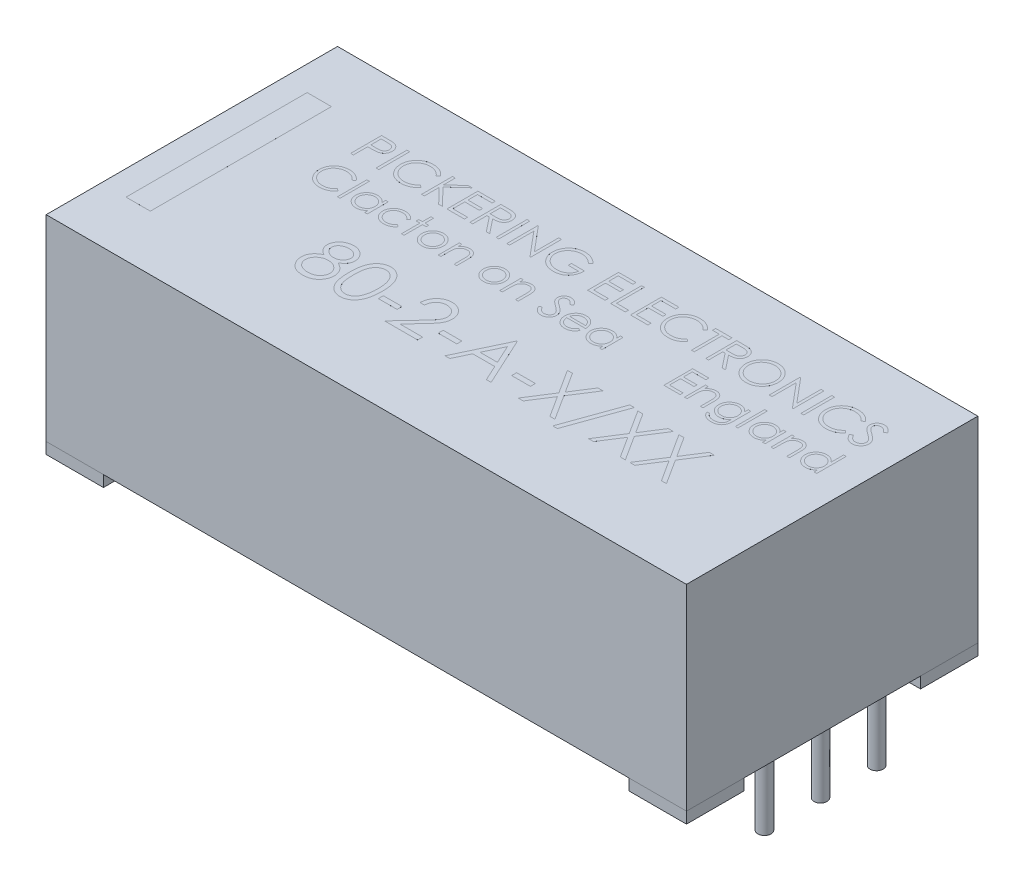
SolidWorks part; units mm, degrees
ref_plane "Front Plane" through (0, 0, 0) normal (0, 0, 1) x (1, 0, 0)
ref_plane "Top Plane" through (0, 0, 0) normal (0, 1, 0) x (1, 0, 0)
ref_plane "Right Plane" through (0, 0, 0) normal (1, 0, 0) x (0, 0, -1)
sketch "Sketch2" plane through (0, 0, 0) normal (0, 1, 0) x (1, 0, 0)
  line L1 (14.5, -6.6) -> (-14.5, -6.6)
  line L2 (14.5, -6.6) -> (14.5, 6.6)
  line L3 (14.5, 6.6) -> (-14.5, 6.6)
  line L4 (-14.5, -6.6) -> (-14.5, 6.6)
  line L5 (14.5, -6.6) -> (-14.5, 6.6) construction
  line L6 (14.5, 6.6) -> (-14.5, -6.6) construction
  point P0 (0, 0)
  dimension "D1" = 13.2
  dimension "D2" = 29
extrude "Main Body" add sketch "Sketch2" along normal blind 8.89 draft 0.023
sketch "Sketch9" plane through (0, 0, 0) normal (0, -1, 0) x (1, 0, 0)
  line L0 (14.5, -6.6) -> (-14.5, -6.6) construction
  line L1 (14.5, 6.6) -> (14.5, -6.6) construction
  circle A0 centre (12.7, -3.81) radius 0.3
  circle A1 centre (12.7, -1.27) radius 0.2963
  circle A2 centre (12.7, 1.27) radius 0.3
  dimension "D1" = 0.6
  dimension "D5" = 0.6
  dimension "D2" = 2.79
  dimension "D3" = 2.54
  dimension "D4" = 1.8
  dimension "D6" = 2.54
extrude "Pins" add sketch "Sketch9" along normal blind 4.31
mirror "Mirror2" about plane through (0, 0, 0) normal (1, 0, 0) of "Pins"
sketch "Sketch10" plane through (0, 0, 0) normal (0, -1, 0) x (1, 0, 0)
  line L1 (14.5, 6.6) -> (11.9, 6.6)
  line L2 (14.5, 6.6) -> (14.5, 4)
  line L3 (14.5, 4) -> (11.9, 4)
  line L4 (11.9, 6.6) -> (11.9, 4)
  dimension "D1" = 2.6
  dimension "D2" = 2.6
extrude "Foot" add sketch "Sketch10" along normal blind 0.51
sketch "Sketch11" plane through (0, -0.51, 0) normal (0, -1, 0) x (1, 0, 0)
  line L0 (14.5, 6.6) -> (11.9, 6.6) construction
  line L1 (11.9, 4) -> (13.95, 4)
  line L2 (11.9, 4) -> (11.9, 6.05)
  line L3 (11.9, 6.05) -> (13.95, 6.05)
  line L4 (13.95, 4) -> (13.95, 6.05)
  line L5 (14.5, 4) -> (14.5, 6.6) construction
  dimension "D1" = 0.55
  dimension "D2" = 0.55
extrude "Extrude2" cut sketch "Sketch11" against normal up to surface (0.51 mm away)
mirror "Mirror3" about plane through (0, 0, 0) normal (0, 0, 1) of "Extrude2", "Foot"
mirror "Mirror4" about plane through (0, 0, 0) normal (1, 0, 0) of "Mirror3", "Foot", "Extrude2"
sketch "Sketch12"
  dimension "D1" = 1.1
  dimension "D2" = 8.2
  dimension "D3" = 2.4965
  dimension "D4" = 1.4
  dimension "D5" = 2
  dimension "D6" = 3.8
extrude "Lettering" add sketch "Sketch12" along normal blind 0.0001
